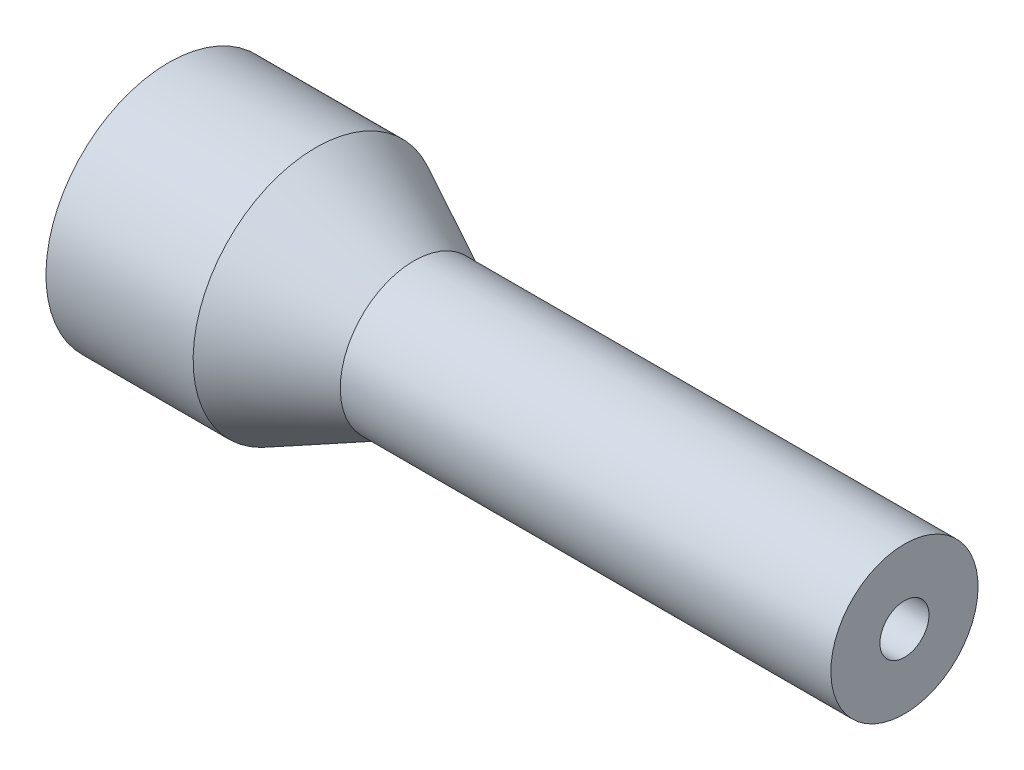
SolidWorks part; units mm, degrees
ref_plane "Płaszczyzna przednia" through (0, 0, 0) normal (0, 0, 1) x (1, 0, 0)
ref_plane "Płaszczyzna górna" through (0, 0, 0) normal (0, 1, 0) x (1, 0, 0)
ref_plane "Płaszczyzna prawa" through (0, 0, 0) normal (1, 0, 0) x (0, 0, -1)
sketch "Szkic1" plane through (0, 0, 0) normal (0, 0, 1) x (1, 0, 0)
  line L0 (0, 19) -> (0, 25)
  line L1 (0, 25) -> (30, 25)
  line L2 (30, 25) -> (50, 15)
  line L3 (50, 15) -> (150, 15)
  line L4 (150, 15) -> (150, 5)
  line L5 (150, 5) -> (130, 5)
  line L6 (130, 5) -> (127.1132, 0)
  line L7 (127.1132, 0) -> (25, 0)
  line L8 (25, 0) -> (25, 19)
  line L9 (25, 19) -> (0, 19)
  line L10 (25, 0) -> (0, 0) construction
  dimension "D1" = 38
  dimension "D2" = 50
  dimension "D3" = 10
  dimension "D4" = 30
  dimension "D5" = 25
  dimension "D6" = 30
  dimension "D7" = 150
  dimension "D8" = 100
  dimension "D9" = 20
  dimension "D10" = 60
revolve "Obrót1" add sketch "Szkic1" angle 360 about L10
